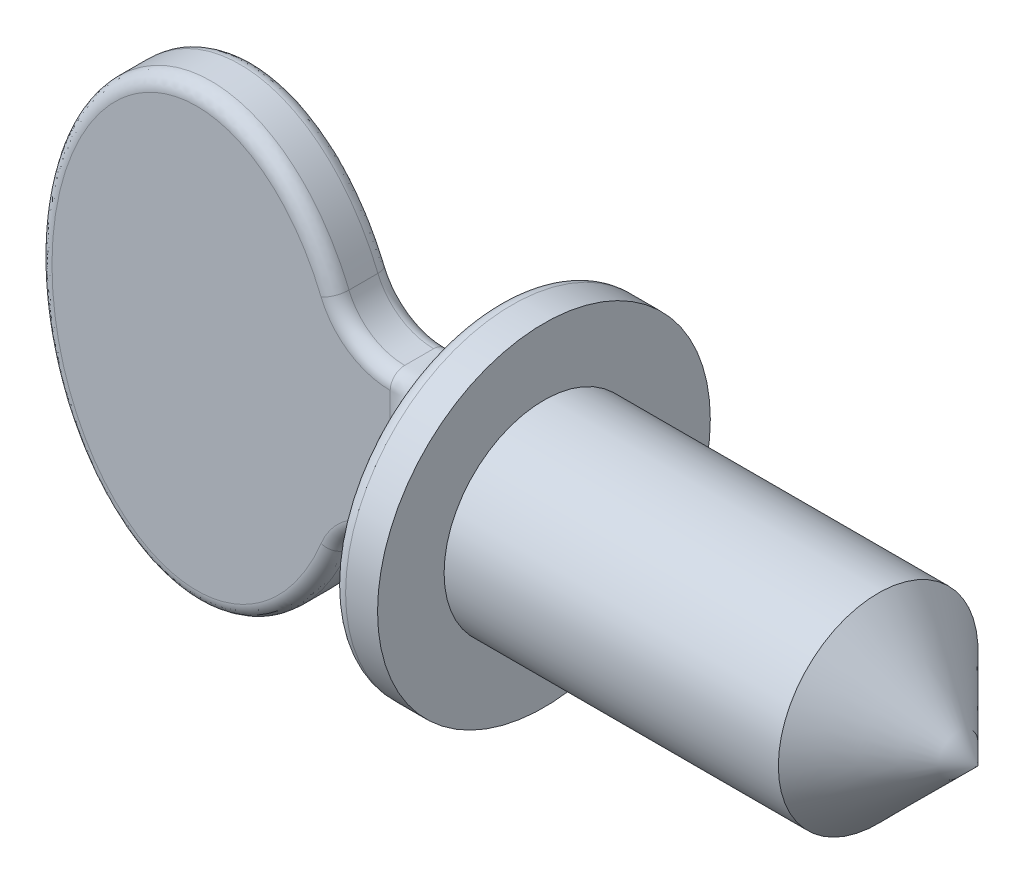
SolidWorks part; units mm, degrees
ref_plane "Front Plane" through (0, 0, 0) normal (0, 0, 1) x (1, 0, 0)
ref_plane "Top Plane" through (0, 0, 0) normal (0, 1, 0) x (1, 0, 0)
ref_plane "Right Plane" through (0, 0, 0) normal (1, 0, 0) x (0, 0, -1)
sketch "layout" plane through (0, 0, 0) normal (0, 0, 1) x (1, 0, 0)
  line L0 (0, 0) -> (13.208, 0) construction
  line L1 (5.588, 2.921) -> (5.588, -2.921)
  line L2 (3.3976, 1.3123) -> (4.8921, 1.3123) construction
  line L3 (5.588, 2.921) -> (4.7897, 2.921)
  line L4 (4.7897, 2.921) -> (4.7897, 3.2655) construction
  line L5 (4.2865, 1.706) -> (4.2865, 0)
  line L6 (4.2865, 1.706) -> (3.3355, 0.7551) construction
  line L7 (13.208, 1.7526) -> (13.208, 0)
  line L8 (3.3976, 1.3123) -> (3.3976, -1.3123)
  line L9 (13.208, 1.7526) -> (5.588, 1.7526)
  arc A0 (3.3976, 1.3123) -> (2.4197, 1.9685) centre (3.3976, 2.3692) cw
  arc A1 (4.7897, 2.921) -> (4.2865, 1.706) centre (3.0715, 2.921) cw
  arc A2 (3.3976, -1.3123) -> (2.4197, -1.9685) centre (3.3976, -2.3692) ccw
  ellipse E0 centre (0, 0) end of major axis (0, 3.937) minor radius 2.794 (2.4197, 1.9685) -> (2.4197, -1.9685) ccw
  dimension "Head Width" = 7.874
  dimension "Shoulder Dia" = 5.842
  dimension "Head Height" = 8.382
  dimension "D4" = 5.588
  dimension "D5" = 2.6247
  dimension "D6" = 3.937
  dimension "D7" = 3.4121
  dimension "D8" = 0.7983
  dimension "D9" = 45
  dimension "Length" = 7.62
  dimension "Base Screw Dia" = 3.5052
sketch "Sketch3" plane through (0, 0, 0) normal (0, 0, 1) x (1, 0, 0)
  line L0 (3.3976, 1.3123) -> (3.3976, -1.3123) construction
  line L1 (3.3976, 1.3123) -> (3.3976, -1.3123)
  arc A0 (3.3976, -1.3123) -> (2.4197, -1.9685) centre (3.3976, -2.3692) ccw construction
  arc A1 (2.4197, 1.9685) -> (3.3976, 1.3123) centre (3.3976, 2.3692) ccw construction
  arc A2 (3.3976, -1.3123) -> (2.4197, -1.9685) centre (3.3976, -2.3692) ccw
  arc A3 (2.4197, 1.9685) -> (3.3976, 1.3123) centre (3.3976, 2.3692) ccw
  ellipse E0 centre (0, 0) end of major axis (0, 3.937) minor radius 2.794 (2.4197, 1.9685) -> (2.4197, -1.9685) ccw construction
  ellipse E1 centre (0, 0) end of major axis (0, 3.937) minor radius 2.794 (2.4197, 1.9685) -> (2.4197, -1.9685) ccw
extrude "Extrude1" add sketch "Sketch3" along normal mid plane 1.016
fillet "Fillet1" radius 0.254 6 edges at (2.8088, 1.4916, -0.508) (2.8088, -1.4916, -0.508) (2.8088, 1.4916, 0.508) (2.8088, -1.4916, 0.508) (-2.794, 0, -0.508) (-2.794, 0, 0.508)
sketch "Sketch4" plane through (0, 0, 0) normal (0, 0, 1) x (1, 0, 0)
  line L0 (13.208, 1.7526) -> (13.208, 0) construction
  line L1 (13.208, 1.7526) -> (5.588, 1.7526) construction
  line L2 (5.588, 2.921) -> (5.588, -2.921) construction
  line L3 (5.588, 2.921) -> (4.7897, 2.921) construction
  line L4 (4.2865, 1.706) -> (4.2865, 0) construction
  line L5 (13.208, 1.7526) -> (13.208, 0) construction
  line L6 (11.4554, 1.7526) -> (5.588, 1.7526)
  line L7 (5.588, 2.921) -> (5.588, 1.7526)
  line L8 (5.588, 2.921) -> (4.7897, 2.921)
  line L9 (4.2865, 1.706) -> (4.2865, 0)
  line L10 (0, 0) -> (16.8942, 0) construction
  line L11 (13.208, 0) -> (4.2865, 0)
  line L12 (13.208, 0) -> (11.4554, 1.7526)
  line L13 (13.208, 0) -> (11.4554, -1.7526) construction
  arc A0 (4.2865, 1.706) -> (4.7897, 2.921) centre (3.0715, 2.921) ccw construction
  arc A1 (4.2865, 1.706) -> (4.7897, 2.921) centre (3.0715, 2.921) ccw
  dimension "D1" = 90
revolve "Revolve1" add sketch "Sketch4" angle 360 about L10
loft "Loft1" add
fillet "Fillet2" radius 0.254 1 edges at (4.7897, 0, 2.921)
sketch "Sketch5" plane through (0, 0, 0) normal (0, 1, 0) x (1, 0, 0)
  line L0 (10.9099, 2.2981) -> (11.4554, 2.2981)
  line L1 (11.4554, 2.2981) -> (11.4554, 1.7526)
  line L2 (11.4554, 1.7526) -> (11.1826, 1.2802)
  line L3 (11.1826, 1.2802) -> (10.9099, 1.7526)
  line L5 (10.9099, 1.7526) -> (10.9099, 2.2981)
  line L6 (11.4554, -1.7526) -> (11.4554, 1.7526) construction
  line L7 (-3.6147, 0) -> (14.1406, 0) construction
  line L8 (11.4554, 1.7526) -> (5.588, 1.7526) construction
  dimension "D1" = 0.4724
revolve "Cut-Revolve10" [suppressed] cut sketch "Sketch5" angle 360 about L7
pattern_linear "LPattern10" [suppressed] count 7 along (1, 0, 0)
equation "\"D4@layout\" = \"Head Height@layout\" / 3 * 2"
equation "\"D5@layout\" = \"Head Width@layout\" / 3"
equation "\"D6@layout\" = \"Head Width@layout\" / 2"
equation "\"D7@layout\" = \"D5@layout\" * 1.3"
equation "\"D8@layout\" = \"D4@layout\"  / 7"
equation "\"D1@Fillet1\" = \"Head Thickness@Extrude1\" / 4"
equation "\"D1@Fillet2\" = \"D1@Fillet1\""
equation "\"D1@Sketch5\" = ( \"Base Screw Dia@layout\"- \"Minor Dia@Cosmetic Thread1\" )  / 2"
equation "\"D1@LPattern10\" = int((\"Length@layout\"-\"Base Screw Dia@layout\"/2)/\"Advance@LPattern10\")"
